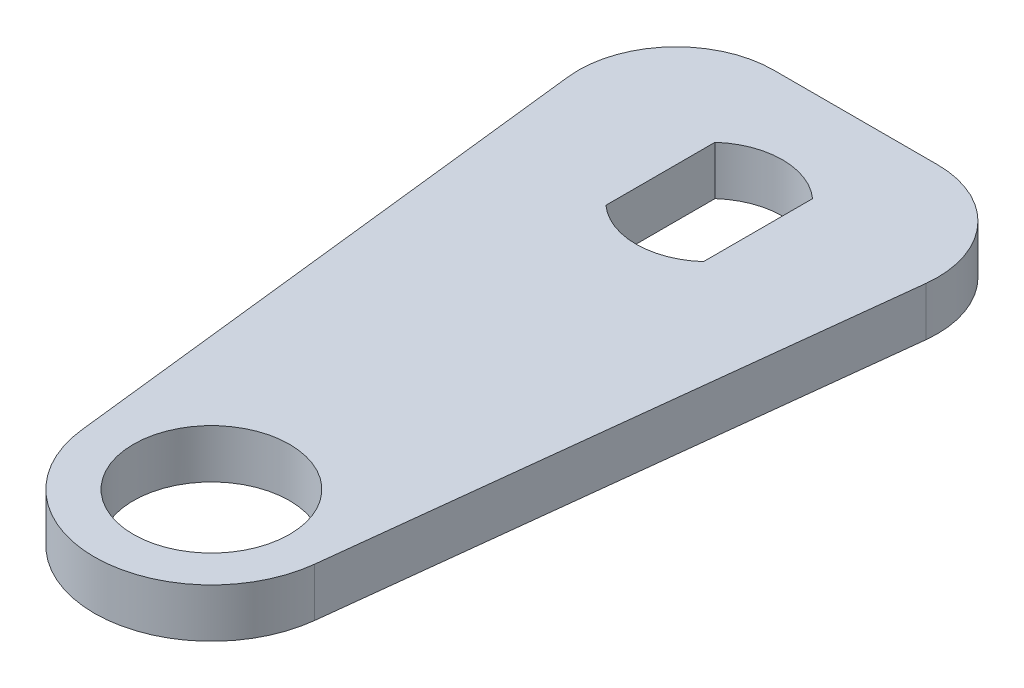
SolidWorks part; units mm, degrees
ref_plane "Plan de face" through (0, 0, 0) normal (0, 0, 1) x (1, 0, 0)
ref_plane "Plan de dessus" through (0, 0, 0) normal (0, 1, 0) x (1, 0, 0)
ref_plane "Plan de droite" through (0, 0, 0) normal (1, 0, 0) x (0, 0, -1)
sketch "Esquisse1" plane through (0, 0, 0) normal (0, 1, 0) x (1, 0, 0)
  line L0 (-11.9229, -52.3584) -> (-19.5974, 15)
  line L1 (11.9229, -52.3584) -> (19.5974, 15)
  line L2 (-5, 5.5902) -> (-5, -5.5902)
  line L3 (19.5974, 15) -> (-19.5974, 15)
  line L4 (5, 5.5902) -> (5, -5.5902)
  line L5 (0, 0) -> (0, -62.1336) construction
  arc A0 (-11.9229, -52.3584) -> (11.9229, -52.3584) centre (0, -51) ccw
  arc A1 (-5, -5.5902) -> (5, -5.5902) centre (0, 0) ccw
  arc A2 (5, 5.5902) -> (-5, 5.5902) centre (0, 0) ccw
  dimension "D1" = 10
  dimension "D2" = 15
  dimension "D3" = 51
  dimension "D4" = 6.5
  dimension "D6" = 15
  dimension "D5" = 24
extrude "Forme pièce" add sketch "Esquisse1" along normal blind 5
fillet "Congé1" radius 10 2 edges at (19.5974, 2.5, -15) (-19.5974, 2.5, -15)
sketch "Esquisse2" plane through (0, 0, 0) normal (0, -1, 0) x (1, 0, 0)
  circle A0 centre (0, 51) radius 8
  arc A1 (11.9229, 52.3584) -> (-11.9229, 52.3584) centre (0, 51) ccw construction
  dimension "D1" = 0
  dimension "D2" = 16
extrude "passage tube" cut sketch "Esquisse2" against normal blind 10
